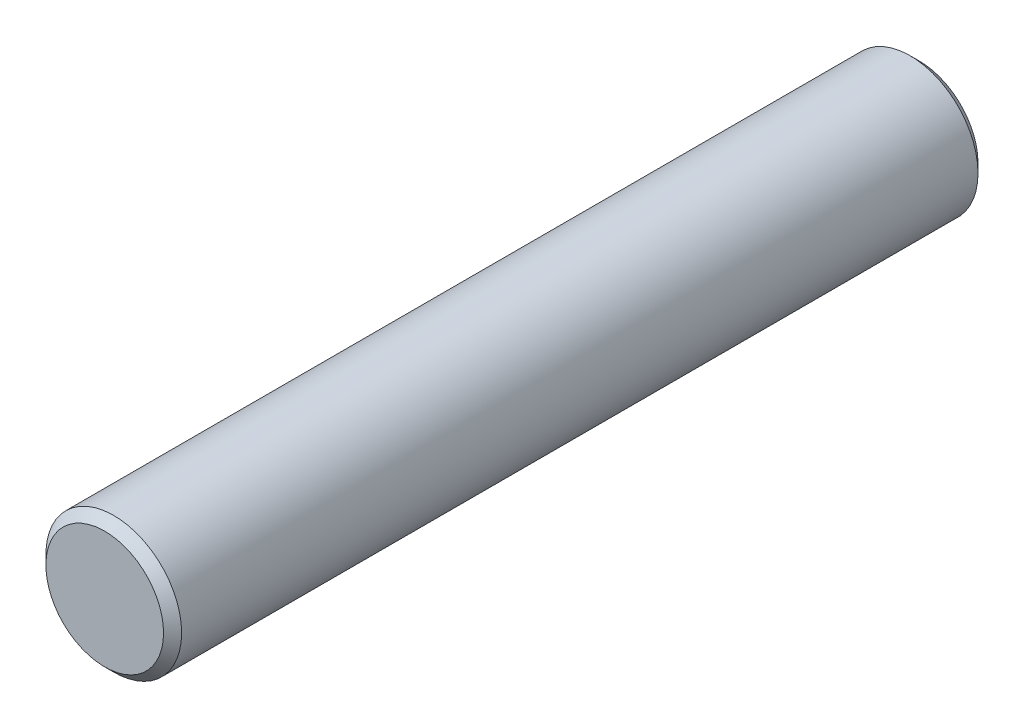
SolidWorks part; units mm, degrees
ref_plane "Plan de face" through (0, 0, 0) normal (0, 0, 1) x (1, 0, 0)
ref_plane "Plan de dessus" through (0, 0, 0) normal (0, 1, 0) x (1, 0, 0)
ref_plane "Plan de droite" through (0, 0, 0) normal (1, 0, 0) x (0, 0, -1)
sketch "Esquisse1" plane through (0, 0, 0) normal (0, 0, 1) x (1, 0, 0)
  circle A0 centre (0, 0) radius 1.5
  dimension "D1" = 3
extrude "Extrusion1" add sketch "Esquisse1" against normal blind 18
chamfer "Chanfrein1" distance 0.2 angle 45 2 edges at (1.5, 0, -18) (1.5, 0, 0)
